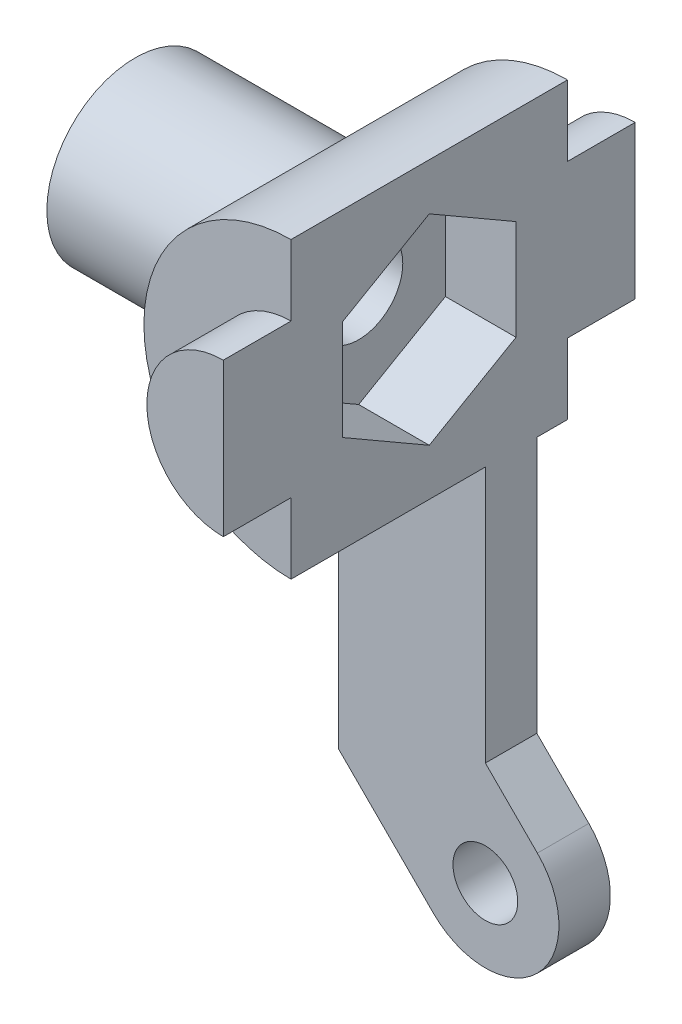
SolidWorks part; units mm, degrees
other "<brazoIzquierdo2>-<<SimetríaCopia de brazoIzquierdo>-<<Copia de brazoIzquierdo>-<Cortar-Extruir4>>>"
ref_plane "Alzado" through (0, 0, 0) normal (0, 0, 1) x (1, 0, 0)
ref_plane "Planta" through (0, 0, 0) normal (0, 1, 0) x (1, 0, 0)
ref_plane "Vista lateral" through (0, 0, 0) normal (1, 0, 0) x (0, 0, -1)
mirrored part "brazoIzquierdo2_Simétrica"
sketch "Croquis2" plane through (-33.5876, 0, 0) normal (1, 0, 0) x (0, 0, -1)
  line L3 (6.9076, 48.8392) -> (6.9076, 51.1546)
  line L4 (6.9076, 51.1546) -> (6.5, 51.1546)
  line L5 (3.5, 51.1546) -> (2, 51.1546)
  line L6 (6.9076, 48.8392) -> (6.9076, 51.1546)
  line L7 (6.9076, 51.1546) -> (6.5, 51.1546)
  line L8 (3.5, 51.1546) -> (2, 51.1546)
  arc A2 (2, 51.1546) -> (6.9076, 48.8392) centre (5, 51.1546) ccw
  arc A3 (3.5, 51.1546) -> (6.5, 51.1546) centre (5, 51.1546) ccw
  arc A4 (2, 51.1546) -> (6.9076, 48.8392) centre (5, 51.1546) ccw
  arc A5 (3.5, 51.1546) -> (6.5, 51.1546) centre (5, 51.1546) ccw
  dimension "D1" = 0
extrude "Saliente-Extruir1" add sketch "Croquis2" along normal up to surface
sketch "Croquis3" plane through (-28.5876, 0, 0) normal (1, 0, 0) x (0, 0, -1)
  line L0 (6.375, 48.773) -> (5, 47.9792) construction
  line L1 (7.75, 49.5669) -> (6.375, 48.773) construction
  line L2 (7.75, 51.1546) -> (7.75, 49.5669) construction
  line L3 (7.75, 52.7423) -> (7.75, 51.1546) construction
  line L4 (6.375, 53.5362) -> (7.75, 52.7423) construction
  line L5 (5, 54.33) -> (6.375, 53.5362) construction
  line L6 (3.625, 53.5362) -> (5, 54.33) construction
  line L7 (2.25, 52.7423) -> (3.625, 53.5362) construction
  line L8 (2.25, 51.1546) -> (2.25, 52.7423) construction
  line L9 (2.25, 49.5669) -> (2.25, 51.1546) construction
  line L10 (3.625, 48.773) -> (2.25, 49.5669) construction
  line L11 (5, 47.9792) -> (3.625, 48.773) construction
  line L12 (6.375, 48.773) -> (5, 47.9792)
  line L13 (7.75, 49.5669) -> (6.375, 48.773)
  line L14 (7.75, 51.1546) -> (7.75, 49.5669)
  line L15 (7.75, 52.7423) -> (7.75, 51.1546)
  line L48 (6.375, 53.5362) -> (7.75, 52.7423)
  line L49 (5, 54.33) -> (6.375, 53.5362)
  line L50 (3.625, 53.5362) -> (5, 54.33)
  line L51 (2.25, 52.7423) -> (3.625, 53.5362)
  line L52 (2.25, 51.1546) -> (2.25, 52.7423)
  line L53 (2.25, 49.5669) -> (2.25, 51.1546)
  line L54 (3.625, 48.773) -> (2.25, 49.5669)
  line L55 (5, 47.9792) -> (3.625, 48.773)
extrude "Cortar-Extruir1" cut sketch "Croquis3" against normal up to surface (2.4 mm away)
sketch "Croquis4" plane through (-30.5876, 0, 0) normal (1, 0, 0) x (0, 0, -1)
  circle A0 centre (0, 51.1546) radius 1 construction
  circle A1 centre (10, 51.1546) radius 1 construction
  circle A2 centre (0, 51.1546) radius 1
  circle A3 centre (10, 51.1546) radius 1
extrude "Saliente-Extruir3" add sketch "Croquis4" against normal blind 0.1
sketch "Croquis5" plane through (-28.5876, 0, 0) normal (1, 0, 0) x (0, 0, -1)
  circle A0 centre (0, 51.1546) radius 1 construction
  circle A1 centre (10, 51.1546) radius 1 construction
  circle A2 centre (0, 51.1546) radius 1
  circle A3 centre (10, 51.1546) radius 1
extrude "Saliente-Extruir4" add sketch "Croquis5" against normal up to surface (2 mm away)
sketch "Croquis6" plane through (-28.5876, 0, 0) normal (1, 0, 0) x (0, 0, -1)
  line L0 (2.25, 52.7423) -> (2.25, 49.5669) construction
  line L1 (2.05, 49.4514) -> (5, 47.7482)
  line L2 (5, 47.7482) -> (7.95, 49.4514)
  line L3 (7.95, 49.4514) -> (7.95, 52.8578)
  line L4 (7.95, 52.8578) -> (5, 54.561)
  line L5 (5, 54.561) -> (2.05, 52.8578)
  line L6 (2.05, 52.8578) -> (2.05, 49.4514)
  circle A0 centre (5, 51.1546) radius 2.95 construction
  dimension "D1" = 5.9
extrude "Cortar-Extruir2" cut sketch "Croquis6" against normal up to surface (2.4 mm away)
sketch "Croquis7" plane through (-28.5876, 0, 0) normal (1, 0, 0) x (0, 0, -1)
  line L0 (-2, 54.1546) -> (0, 54.1546)
  line L1 (0, 54.1546) -> (0, 56.1546)
  line L2 (0, 56.1546) -> (0.3, 56.1546)
  line L3 (10, 56.1546) -> (0, 56.1546) construction
  line L4 (0.3, 56.1546) -> (0.3, 53.7546)
  line L5 (0.3, 53.7546) -> (-2, 53.7546)
  line L6 (-2, 54.1546) -> (-2, 48.1546) construction
  line L7 (-2, 53.7546) -> (-2, 54.1546)
  line L8 (10, 56.1546) -> (10, 54.1546)
  line L9 (10, 54.1546) -> (12, 54.1546)
  line L10 (12, 54.1546) -> (12, 53.7546)
  line L11 (12, 48.1546) -> (12, 54.1546) construction
  line L12 (12, 53.7546) -> (9.7, 53.7546)
  line L13 (9.7, 53.7546) -> (9.7, 56.1546)
  line L14 (9.7, 56.1546) -> (10, 56.1546)
  line L15 (-4.5504, 51.1546) -> (15.2557, 51.1546) construction
  dimension "D1" = 0.4
  dimension "D2" = 0.3
  dimension "D3" = 0.3
  dimension "D4" = 0.4
revolve "Cortar-Revolución1" cut sketch "Croquis7" angle 360 about L15
sketch "Croquis8" plane through (0, 0, -8.6576) normal (0, 0, -1) x (-1, 0, 0)
  circle A0 centre (28.5876, 33.9031) radius 1.1
  dimension "D1" = 2.2
extrude "Cortar-Extruir3" cut sketch "Croquis8" against normal up to surface (1.75 mm away)
